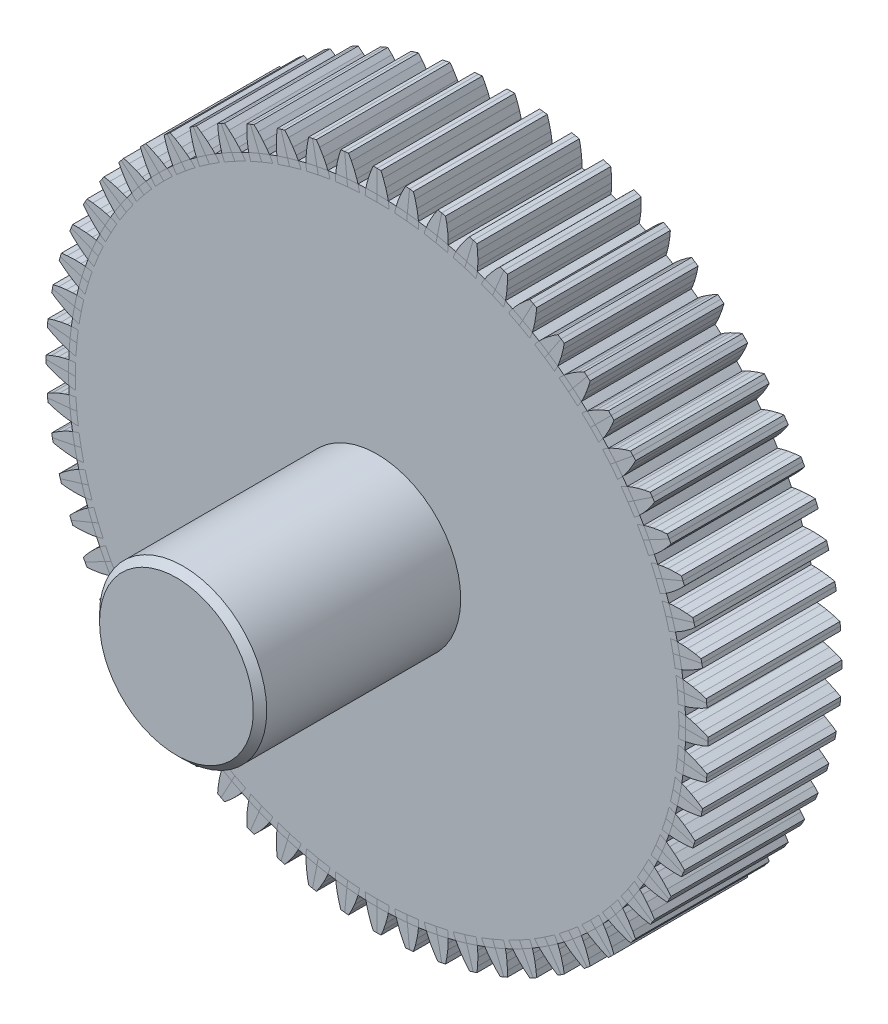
SolidWorks part; units mm, degrees
ref_plane "Plan1" through (0, 0, 0) normal (0, 0, 1) x (1, 0, 0)
ref_plane "Plan2" through (0, 0, 0) normal (0, 1, 0) x (1, 0, 0)
ref_plane "Plan3" through (0, 0, 0) normal (1, 0, 0) x (0, 0, -1)
imported_body "Importée1"
sketch "Esquisse1" plane through (0, 0, 0) normal (0, 0, 1) x (1, 0, 0)
  circle A0 centre (0, 0) radius 42.435
  circle A1 centre (0, 0) radius 42.435 construction
extrude "matiere" add sketch "Esquisse1" against normal up to surface (20 mm away)
sketch "Esquisse2" plane through (0, 0, 0) normal (1, 0, 0) x (0, 0, -1)
  line L0 (0, 0) -> (51.2405, 0) construction
  line L1 (0, 0) -> (20, 0) construction
  line L2 (34, 0) -> (34, 10)
  line L3 (34, 10) -> (26, 10)
  line L4 (26, 9) -> (26, 10)
  line L5 (26, 9) -> (24, 9)
  line L6 (24, 9) -> (24, 13)
  line L7 (24, 13) -> (0, 13)
  line L8 (0, 13) -> (0, 12.5)
  line L9 (0, 12.5) -> (-30, 12.5)
  line L10 (-30, 12.5) -> (-30, 0)
  line L11 (-30, 0) -> (34, 0)
  dimension "D1" = 24
  dimension "D2" = 2
  dimension "D3" = 8
  dimension "D4" = 20
  dimension "D5" = 18
  dimension "D6" = 26
  dimension "D7" = 25
  dimension "D8" = 30
revolve "ARBRE" add sketch "Esquisse2" angle 360 about L0
chamfer "Chanfrein1" distance 1 angle 45
chamfer "Chanfrein FILETAGE" distance 1 angle 45
